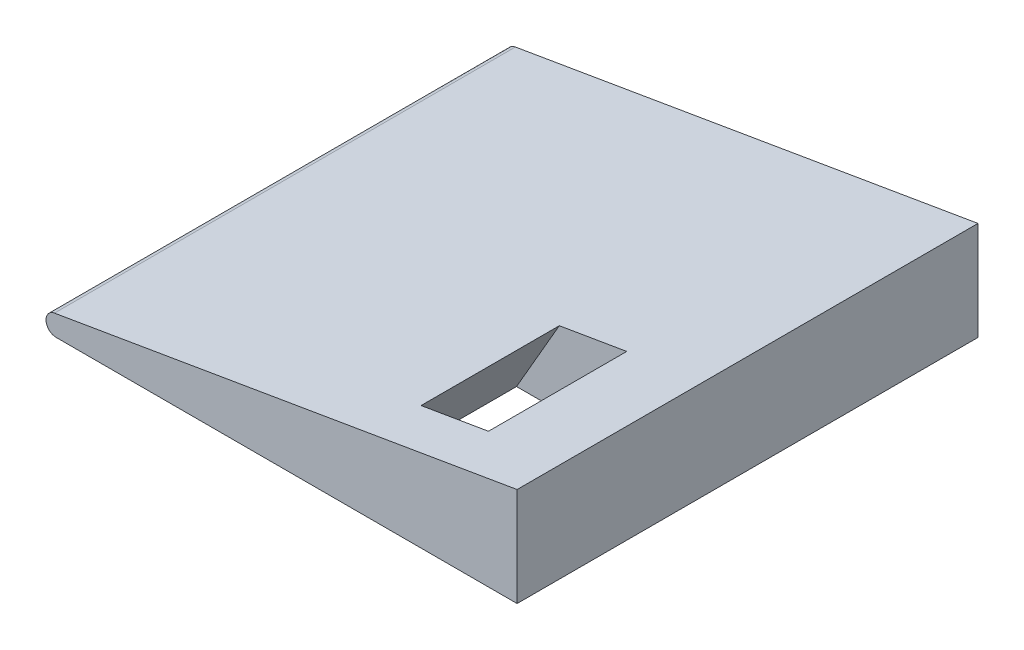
SolidWorks part; units mm, degrees
ref_plane "Front" through (0, 0, 0) normal (0, 0, 1) x (1, 0, 0)
ref_plane "Top" through (0, 0, 0) normal (0, 1, 0) x (1, 0, 0)
ref_plane "Right" through (0, 0, 0) normal (1, 0, 0) x (0, 0, -1)
sketch "Sketch1" plane through (0, 0, 0) normal (0, 0, 1) x (1, 0, 0)
  line L0 (0, 0) -> (-355.6, 0)
  line L1 (-356.9157, 15.6129) -> (0, 76.2)
  line L2 (0, 76.2) -> (0, 0)
  arc A0 (-355.6, 0) -> (-356.9157, 15.6129) centre (-355.6, 7.8619) cw
  dimension "D1" = 355.6
  dimension "D2" = 76.2
extrude "Base-Extrude" add sketch "Sketch1" along normal mid plane 355.6
sketch "Sketch3" plane through (53.0732, 91.9255, 0) normal (0.5, 0.866, 0) x (-0.866, 0.5, 0)
  line L0 (125.7483, 92.71) -> (125.7483, 118.11) construction
  line L1 (85.1083, 33.02) -> (125.7483, 33.02)
  line L2 (85.1083, 33.02) -> (85.1083, 139.7)
  line L3 (85.1083, 139.7) -> (125.7483, 139.7)
  line L4 (125.7483, 33.02) -> (125.7483, 139.7)
  line L5 (121.9383, 139.7) -> (85.1083, 139.7) construction
sketch "Sketch2" plane through (0, 0, 0) normal (0, -1, 0) x (1, 0, 0)
  line L0 (-355.6, 177.8) -> (0, 177.8) construction
  line L2 (-293.4478, 177.8) -> (-15.147, 177.8)
  line L3 (-293.4478, 177.8) -> (-293.4478, -177.8)
  line L4 (-293.4478, -177.8) -> (-15.147, -177.8)
  line L5 (-15.147, 177.8) -> (-15.147, -177.8)
  line L6 (-355.6, -177.8) -> (0, -177.8) construction
extrude "Cut-Extrude4" cut sketch "Sketch3" against normal through all
ref_plane "Plane1" through (53.0732, 91.9255, 0) normal (0.5, 0.866, 0) x (-0.866, 0.5, 0)
shell "Shell1" thickness 1.016
sketch "Sketch4" plane through (159.396, 276.0821, 0) normal (0.5, 0.866, 0) x (-0.866, 0.5, 0)
  line L4 (85.1083, 33.02) -> (125.7483, 33.02)
  line L5 (125.7483, 33.02) -> (125.7483, 139.7)
  line L6 (125.7483, 139.7) -> (85.1083, 139.7)
  line L7 (85.1083, 139.7) -> (85.1083, 33.02)
  line L8 (85.1083, 33.02) -> (125.7483, 33.02)
  line L9 (125.7483, 33.02) -> (125.7483, 139.7)
  line L10 (125.7483, 139.7) -> (85.1083, 139.7)
  line L11 (85.1083, 139.7) -> (85.1083, 33.02)
  dimension "D1" = 0
extrude "Cut-Extrude6" cut sketch "Sketch4" against normal through all
sheet metal parameters "Sheet-Metal1" thickness 1.016 parameters "D1"=1.27
bend "SharpBend1" bend angle 90 parameters "D1"=0, "D5"=1
flatten bends "Flatten-Bends1"
sketch "Sharp-Sketch1" plane through (-12.5728, 74.0657, 0) normal (-0.1674, 0.9859, 0) x (-0.9859, -0.1674, 0)
  line L0 (-85.4849, -177.8) -> (-85.4849, 177.8) construction
  line L1 (-11.5035, -177.8) -> (-11.5035, 177.8) construction
  line L2 (360.0511, 177.8) -> (360.0511, -177.8) construction
bend "SharpBend2" bend angle 99.634 parameters "D1"=0, "D5"=2
bend "RoundBend1" bend radius 6.8459 bend angle 170.366 parameters "D5"=3
process bends "Process-Bends1" parameters "D1"=0
sketch "Flat-Sketch1" plane through (-12.5728, 74.0657, 0) normal (-0.1674, 0.9859, 0) x (-0.9859, -0.1674, 0)
